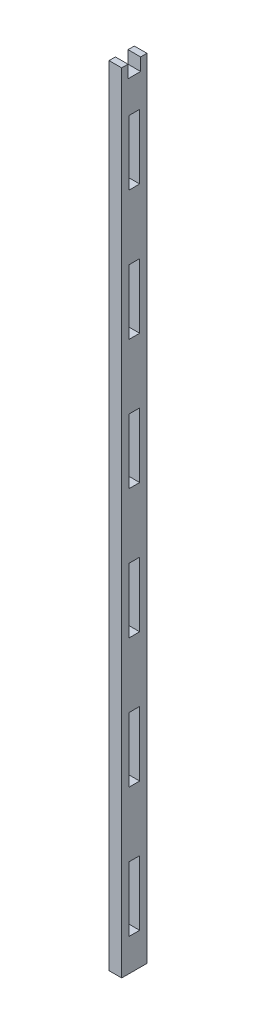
SolidWorks part; units mm, degrees
ref_plane "Front Plane" through (0, 0, 0) normal (0, 0, 1) x (1, 0, 0)
ref_plane "Top Plane" through (0, 0, 0) normal (0, 1, 0) x (1, 0, 0)
ref_plane "Right Plane" through (0, 0, 0) normal (1, 0, 0) x (0, 0, -1)
sketch "Sketch1" plane through (0, 0, 0) normal (1, 0, 0) x (0, 0, -1)
  line L1 (0, 0) -> (6.35, 0)
  line L2 (0, 0) -> (0, 198.4375)
  line L3 (0, 198.4375) -> (6.35, 198.4375)
  line L4 (6.35, 0) -> (6.35, 198.4375)
extrude "Boss-Extrude1" add sketch "Sketch1" along normal blind 3.175
sketch "Sketch2" plane through (3.175, 0, 0) normal (1, 0, 0) x (0, 0, -1)
  line L0 (3.175, 198.4375) -> (3.175, 0) construction
  line L1 (6.35, 198.4375) -> (0, 198.4375) construction
  line L2 (0, 0) -> (6.35, 0) construction
  line L4 (1.5875, 201.6125) -> (4.7625, 201.6125)
  line L5 (1.5875, 201.6125) -> (1.5875, 195.2625)
  line L6 (1.5875, 195.2625) -> (4.7625, 195.2625)
  line L7 (4.7625, 201.6125) -> (4.7625, 195.2625)
  line L8 (1.5875, 201.6125) -> (4.7625, 195.2625) construction
  line L9 (1.5875, 195.2625) -> (4.7625, 201.6125) construction
extrude "Cut-Extrude1" cut sketch "Sketch2" against normal through all
sketch "Sketch3" plane through (3.175, 0, 0) normal (1, 0, 0) x (0, 0, -1)
  line L0 (3.175, 0) -> (3.175, 195.2625) construction
  line L1 (0, 0) -> (6.35, 0) construction
  line L2 (1.5875, 195.2625) -> (4.7625, 195.2625) construction
  line L4 (1.8269, 8.1359) -> (4.5231, 8.1359)
  line L5 (1.8269, 8.1359) -> (1.8269, 24.4078)
  line L6 (1.8269, 24.4078) -> (4.5231, 24.4078)
  line L7 (4.5231, 8.1359) -> (4.5231, 24.4078)
  line L8 (1.8269, 8.1359) -> (4.5231, 24.4078) construction
  line L9 (1.8269, 24.4078) -> (4.5231, 8.1359) construction
  point P6 (3.175, 16.2719)
extrude "Cut-Extrude2" cut sketch "Sketch3" against normal through all
pattern_linear "LPattern1" count 6 spacing 32.5437 along (0, 1, 0) of "Cut-Extrude2"
sketch "Sketch4" plane through (3.175, 0, 0) normal (1, 0, 0) x (0, 0, -1)
  line L16 (6.604, 198.6915) -> (4.5085, 198.6915)
  line L17 (4.5085, 198.6915) -> (4.5085, 195.5165)
  line L18 (4.5085, 195.5165) -> (1.8415, 195.5165)
  line L19 (1.8415, 195.5165) -> (1.8415, 198.6915)
  line L20 (1.8415, 198.6915) -> (-0.254, 198.6915)
  line L21 (-0.254, 198.6915) -> (-0.254, -0.254)
  line L22 (-0.254, -0.254) -> (6.604, -0.254)
  line L23 (6.604, -0.254) -> (6.604, 198.6915)
  line L24 (6.604, 198.6915) -> (4.5085, 198.6915)
  line L25 (4.5085, 198.6915) -> (4.5085, 195.5165)
  line L26 (4.5085, 195.5165) -> (1.8415, 195.5165)
  line L27 (1.8415, 195.5165) -> (1.8415, 198.6915)
  line L28 (1.8415, 198.6915) -> (-0.254, 198.6915)
  line L29 (-0.254, 198.6915) -> (-0.254, -0.254)
  line L30 (-0.254, -0.254) -> (6.604, -0.254)
  line L31 (6.604, -0.254) -> (6.604, 198.6915)
  line L59 (2.0809, 171.1087) -> (4.2691, 171.1087)
  line L60 (4.2691, 171.1087) -> (4.2691, 186.8726)
  line L61 (4.2691, 186.8726) -> (2.0809, 186.8726)
  line L62 (2.0809, 186.8726) -> (2.0809, 171.1087)
  line L63 (2.0809, 171.1087) -> (4.2691, 171.1087)
  line L64 (4.2691, 171.1087) -> (4.2691, 186.8726)
  line L65 (4.2691, 186.8726) -> (2.0809, 186.8726)
  line L66 (2.0809, 186.8726) -> (2.0809, 171.1087)
  line L71 (2.0809, 138.5649) -> (4.2691, 138.5649)
  line L72 (2.0809, 154.3288) -> (2.0809, 138.5649)
  line L73 (4.2691, 154.3288) -> (2.0809, 154.3288)
  line L74 (4.2691, 138.5649) -> (4.2691, 154.3288)
  line L75 (2.0809, 138.5649) -> (4.2691, 138.5649)
  line L76 (2.0809, 154.3288) -> (2.0809, 138.5649)
  line L77 (4.2691, 154.3288) -> (2.0809, 154.3288)
  line L78 (4.2691, 138.5649) -> (4.2691, 154.3288)
  line L83 (2.0809, 106.0212) -> (4.2691, 106.0212)
  line L84 (2.0809, 121.7851) -> (2.0809, 106.0212)
  line L85 (4.2691, 121.7851) -> (2.0809, 121.7851)
  line L86 (4.2691, 106.0212) -> (4.2691, 121.7851)
  line L87 (2.0809, 106.0212) -> (4.2691, 106.0212)
  line L88 (2.0809, 121.7851) -> (2.0809, 106.0212)
  line L89 (4.2691, 121.7851) -> (2.0809, 121.7851)
  line L90 (4.2691, 106.0212) -> (4.2691, 121.7851)
  line L95 (2.0809, 73.4774) -> (4.2691, 73.4774)
  line L96 (2.0809, 89.2413) -> (2.0809, 73.4774)
  line L97 (4.2691, 89.2413) -> (2.0809, 89.2413)
  line L98 (4.2691, 73.4774) -> (4.2691, 89.2413)
  line L99 (2.0809, 73.4774) -> (4.2691, 73.4774)
  line L100 (2.0809, 89.2413) -> (2.0809, 73.4774)
  line L101 (4.2691, 89.2413) -> (2.0809, 89.2413)
  line L102 (4.2691, 73.4774) -> (4.2691, 89.2413)
  line L107 (2.0809, 40.9337) -> (4.2691, 40.9337)
  line L108 (2.0809, 56.6976) -> (2.0809, 40.9337)
  line L109 (4.2691, 56.6976) -> (2.0809, 56.6976)
  line L110 (4.2691, 40.9337) -> (4.2691, 56.6976)
  line L111 (2.0809, 40.9337) -> (4.2691, 40.9337)
  line L112 (2.0809, 56.6976) -> (2.0809, 40.9337)
  line L113 (4.2691, 56.6976) -> (2.0809, 56.6976)
  line L114 (4.2691, 40.9337) -> (4.2691, 56.6976)
  line L119 (2.0809, 8.3899) -> (4.2691, 8.3899)
  line L120 (2.0809, 24.1538) -> (2.0809, 8.3899)
  line L121 (4.2691, 24.1538) -> (2.0809, 24.1538)
  line L122 (4.2691, 8.3899) -> (4.2691, 24.1538)
  line L123 (2.0809, 8.3899) -> (4.2691, 8.3899)
  line L124 (2.0809, 24.1538) -> (2.0809, 8.3899)
  line L125 (4.2691, 24.1538) -> (2.0809, 24.1538)
  line L126 (4.2691, 8.3899) -> (4.2691, 24.1538)
  dimension "D1" = 0.254
  dimension "D2" = 0.254
  dimension "D3" = 0.254
  dimension "D4" = 0.254
  dimension "D5" = 0.254
  dimension "D6" = 0.254
  dimension "D7" = 0.254
equation "\"SideHeight@Sketch1\"= \"hb\" - 2 * \"t\""
equation "\"SideWidth@Sketch1\"= 2 * \"t\""
equation "\"TwiceSlotWidth@Sketch2\" = 2 * \"t\""
equation "\"t\"= .125in"
equation "\"hb\"= 8.0625in"
equation "\"Nb\"= 6"
equation "\"SlotHeight@Sketch3\"= ( \"hb\" - 3 * \"t\" ) / 2 / \"Nb\""
equation "\"SlotHeightToo@Sketch3\"= ( \"hb\" - 3 * \"t\" ) / 2 / \"Nb\""
equation "\"SlotWidth@Sketch2\"= \"t\""
equation "\"D1@Boss-Extrude1\"= \"t\""
equation "\"D1@LPattern1\"= \"Nb\""
equation "\"D3@LPattern1\"= ( \"hb\" - 3 * \"t\" ) / \"Nb\""
